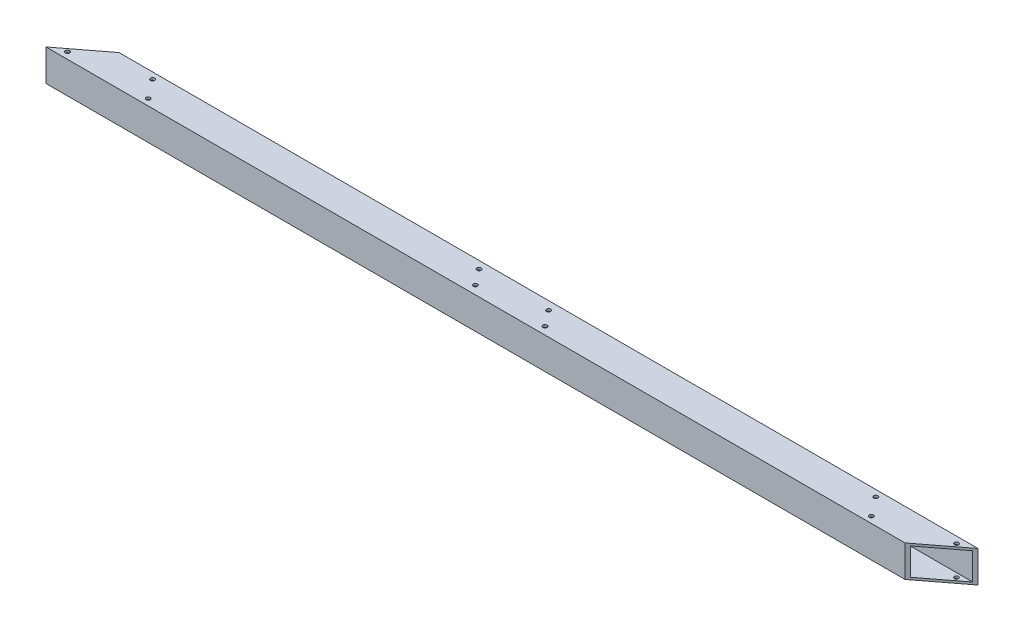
SolidWorks part; units mm, degrees
ref_plane "Front" through (0, 0, 0) normal (0, 0, 1) x (1, 0, 0)
ref_plane "Top" through (0, 0, 0) normal (0, 1, 0) x (1, 0, 0)
ref_plane "Right" through (0, 0, 0) normal (1, 0, 0) x (0, 0, -1)
sketch "Sketch1" plane through (0, 0, 0) normal (1, 0, 0) x (0, 0, -1)
  line L1 (0, 0) -> (50.8, 0)
  line L2 (0, 0) -> (0, 50.8)
  line L3 (0, 50.8) -> (50.8, 50.8)
  line L4 (50.8, 0) -> (50.8, 50.8)
  line L5 (3.6576, 47.1424) -> (47.1424, 47.1424)
  line L6 (3.6576, 47.1424) -> (3.6576, 3.6576)
  line L7 (3.6576, 3.6576) -> (47.1424, 3.6576)
  line L8 (47.1424, 47.1424) -> (47.1424, 3.6576)
  dimension "D1" = 50.8
  dimension "D2" = 50.8
  dimension "D3" = 3.6576
  dimension "D4" = 3.6576
  dimension "D5" = 3.6576
  dimension "D6" = 3.6576
extrude "Extrude1" add sketch "Sketch1" along normal blind 3048
sketch "Sketch3" plane through (0, 0, -50.8) normal (0, 0, -1) x (-1, 0, 0)
  line L5 (0, 0) -> (0, -664.0913) construction
  line L6 (0, -664.0913) -> (-3047.8384, -664.0913) construction
  line L7 (-3047.8384, 0) -> (-3047.8384, -664.0913) construction
  line L8 (-1523.9192, -664.0913) -> (-1523.9192, 171.6838) construction
  circle A0 centre (-95.6188, 12.3324) radius 3.3731
  circle A1 centre (-57.6849, 37.9799) radius 3.3731
  circle A2 centre (-3028.95, 12.7) radius 3.3731
  circle A4 centre (-19.4204, 12.8284) radius 3.3731
  circle A5 centre (-2952.2196, 12.3324) radius 3.3731
  circle A6 centre (-2990.85, 38.1) radius 3.3731
  point P0 (-3047.8384, 0)
extrude "Cut-Extrude2" [suppressed] cut sketch "Sketch3" against normal through all
sketch "Sketch4" plane through (0, 0, -50.8) normal (0, 0, -1) x (-1, 0, 0)
  circle A0 centre (-2235.1466, 25.4) radius 3.3731
  circle A1 centre (-2298.6466, 25.4) radius 3.3731
  circle A2 centre (-2362.1466, 25.4) radius 3.3731
  circle A3 centre (-812.7466, 25.4) radius 3.3731
  circle A4 centre (-749.2466, 25.4) radius 3.3731
  circle A5 centre (-685.7466, 25.4) radius 3.3731
  dimension "D1" = 6.7462
extrude "Cut-Extrude3" [suppressed] cut sketch "Sketch4" against normal through all
sketch "Sketch5" plane through (0, 0, -50.8) normal (0, 0, -1) x (-1, 0, 0)
  circle A0 centre (-1536.7, 38.1) radius 3.3731
  circle A1 centre (-1511.2466, 12.7) radius 3.3731
  dimension "D1" = 6.7462
sketch "Sketch6" plane through (0, 0, -50.8) normal (0, 0, -1) x (-1, 0, 0)
  circle A0 centre (-1524.0534, 25.4) radius 3.3731
  circle A1 centre (-1460.5534, 25.4) radius 3.3731
  circle A2 centre (-1587.5534, 25.4) radius 3.3731
  circle A3 centre (-736.6534, 12.7) radius 3.3731
  circle A4 centre (-762.0534, 38.1) radius 3.3731
  circle A5 centre (-2311.4534, 38.1) radius 3.3731
  circle A6 centre (-2286.0534, 12.7) radius 3.3731
  dimension "D1" = 6.7462
  dimension "D2" = 6.7462
  dimension "D3" = 6.7462
extrude "Cut-Extrude4" [suppressed] cut sketch "Sketch6" against normal through all
sketch "Sketch7" plane through (0, 0, -50.8) normal (0, 0, -1) x (-1, 0, 0)
  circle A0 centre (-1536.7, 38.1) radius 3.3731
  circle A1 centre (-1511.2466, 12.7) radius 3.3731
  dimension "D1" = 6.7462
  dimension "D2" = 6.7462
extrude "Cut-Extrude5" [suppressed] cut sketch "Sketch7" against normal through all
sketch "Sketch8" plane through (0, 0, 0) normal (0, 0, 1) x (1, 0, 0)
  line L0 (1524, 50.8) -> (1524, 207.5111) construction
  line L1 (3048, 50.8) -> (0, 50.8) construction
  circle A0 centre (95.25, 12.7) radius 3.304
  circle A1 centre (57.15, 38.1) radius 3.1902
  circle A2 centre (19.05, 12.7) radius 3.304
  circle A3 centre (3028.95, 12.7) radius 3.304
  circle A4 centre (2990.85, 38.1) radius 3.1902
  circle A5 centre (2952.75, 12.7) radius 3.304
extrude "Cut-Extrude6" [suppressed] cut sketch "Sketch8" against normal through all
sketch "Sketch9" plane through (0, 0, -50.8) normal (0, 0, -1) x (-1, 0, 0)
  circle A0 centre (-44.45, 38.1) radius 3.3731
  circle A1 centre (-3003.55, 12.7) radius 3.3731
  circle A2 centre (-3028.95, 38.1) radius 3.3731
  dimension "D1" = 6.7462
  dimension "D2" = 6.7462
extrude "Cut-Extrude7" [suppressed] cut sketch "Sketch9" against normal through all
sketch "Sketch10" plane through (0, 0, 0) normal (0, 0, 1) x (1, 0, 0)
  line L1 (3407.5044, 166.4746) -> (1445.514, 166.4746)
  line L2 (3407.5044, 166.4746) -> (3407.5044, -140.6406)
  line L3 (3407.5044, -140.6406) -> (1445.514, -140.6406)
  line L4 (1445.514, 166.4746) -> (1445.514, -140.6406)
  dimension "D1" = 1445.514
extrude "Extrude2" cut sketch "Sketch10" against normal through all
sketch "Sketch11" plane through (0, 0, 0) normal (0, 0, 1) x (1, 0, 0)
  line L0 (0, 0) -> (1444.7168, 50.8) construction
  line L1 (1445.514, 50.8) -> (0, 50.8) construction
  line L3 (1444.7168, 50.8) -> (1448.6138, 50.8)
  line L4 (1444.7168, 50.8) -> (1444.7168, -1.6077)
  line L5 (1444.7168, -1.6077) -> (1448.6138, -1.6077)
  line L6 (1448.6138, 50.8) -> (1448.6138, -1.6077)
  dimension "D1" = 1445.6097
extrude "Extrude3" cut sketch "Sketch11" against normal through all
sketch "Sketch12" plane through (0, 0, 0) normal (0, -1, 0) x (1, 0, 0)
  line L0 (0, 0) -> (88.9938, -68.169)
  line L1 (1444.7168, 0) -> (0, 0) construction
  line L2 (88.9938, -68.169) -> (0, -57.6525)
  line L3 (0, -57.6525) -> (0, 0)
  line L4 (1444.7168, -50.8) -> (1366.8578, 8.8399)
  line L5 (1444.7168, -50.8) -> (0, -50.8) construction
  line L6 (1444.7168, -50.8) -> (1444.7168, 0) construction
  line L7 (1366.8578, 8.8399) -> (1444.7168, 8.8399)
  line L8 (1444.7168, 8.8399) -> (1444.7168, -50.8)
extrude "Cut-Extrude8" cut sketch "Sketch12" against normal through all
sketch "Sketch13" plane through (0, 0, 0) normal (0, -1, 0) x (1, 0, 0)
  line L0 (654.1834, 0) -> (654.1834, -50.8) construction
  line L1 (1378.3981, 0) -> (0, 0) construction
  line L2 (1444.7168, -50.8) -> (66.3187, -50.8) construction
  point P12 (722.3584, -25.4)
sketch "Sketch14" plane through (0, 0, 0) normal (0, -1, 0) x (1, 0, 0)
  circle A0 centre (788.5369, -12.1017) radius 3.3921
  circle A1 centre (769.2299, -37.3068) radius 3.3921
  circle A4 centre (675.487, -13.4932) radius 3.3921
  circle A5 centre (656.1799, -38.6983) radius 3.3921
extrude "Cut-Extrude9" cut sketch "Sketch14" against normal through all
sketch "Sketch15" plane through (0, 0, 0) normal (0, -1, 0) x (1, 0, 0)
  line L0 (326.6874, 0) -> (326.6874, -50.8) construction
  line L2 (1378.3981, 0) -> (0, 0) construction
  line L3 (1444.7168, -50.8) -> (66.3187, -50.8) construction
  line L4 (722.3584, 62.5908) -> (722.3584, 138.5935) construction
  line L5 (326.6874, -25.4) -> (368.5863, -25.4) construction
  circle A0 centre (1314.2093, -10.2328) radius 3.3731
  circle A1 centre (1291.0408, -40.479) radius 3.3731
  circle A2 centre (1420.7349, -40.3384) radius 3.3731
  circle A4 centre (153.6761, -10.321) radius 3.3731
  circle A6 centre (130.5076, -40.5672) radius 3.3731
  circle A7 centre (23.9819, -10.4616) radius 3.3731
  point P24 (23.9819, -10.4616)
  point P25 (130.5076, -40.5672)
  point P26 (153.6761, -10.321)
  point P30 (23.9819, -10.4616)
  dimension "D1" = 6.7462
  dimension "D2" = 6.7462
extrude "Cut-Extrude10" cut sketch "Sketch15" against normal through all
